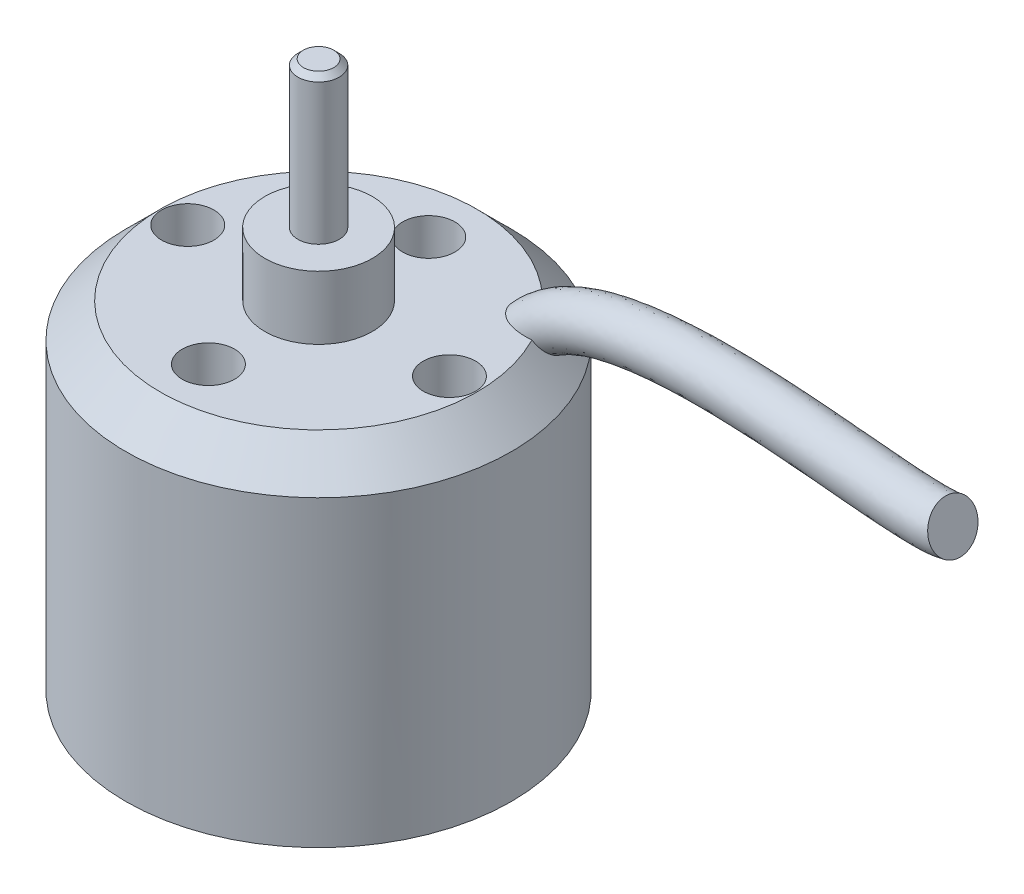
SolidWorks part; units mm, degrees
ref_plane "Plan de face" through (0, 0, 0) normal (0, 0, 1) x (1, 0, 0)
ref_plane "Plan de dessus" through (0, 0, 0) normal (0, 1, 0) x (1, 0, 0)
ref_plane "Plan de droite" through (0, 0, 0) normal (1, 0, 0) x (0, 0, -1)
sketch "Esquisse1" plane through (0, 0, 0) normal (0, 0, 1) x (1, 0, 0)
  line L0 (4, 0.4) -> (1.5, 0.4)
  line L1 (4, 0.4) -> (4, 5)
  line L2 (4, 5) -> (14, 5)
  line L3 (14, 5) -> (14, 27)
  line L4 (14, 27) -> (11.5, 29.5)
  line L5 (11.5, 29.5) -> (3.9, 29.5)
  line L6 (3.9, 29.5) -> (3.9, 34.1)
  line L7 (3.9, 34.1) -> (1.5, 34.1)
  line L8 (1.5, 34.1) -> (1.5, 44.3)
  line L9 (1.1, 44.7) -> (0, 44.7)
  line L10 (1.5, 0.4) -> (1.5, 0)
  line L11 (1.5, 0) -> (0, 0)
  line L12 (1.5, 44.3) -> (1.1, 44.7)
  line L13 (0, 44.7) -> (0, 0)
  point P9 (1.5, 44.7)
  dimension "D1" = 44.7
  dimension "D3" = 5
  dimension "D4" = 4.6
  dimension "D7" = 24.5
  dimension "D8" = 45
  dimension "D11" = 10.6
  dimension "D14" = 0.4
revolve "Révolution1" add sketch "Esquisse1" angle 360 about L13
sketch "Esquisse2" plane through (0, 29.5, 0) normal (0, 1, 0) x (1, 0, 0)
  line L0 (9.5, 0) -> (-9.5, 0) construction
  line L1 (0, 0) -> (0, -8) construction
  circle A0 centre (9.5, 0) radius 1.9
  circle A1 centre (-9.5, 0) radius 1.9
  circle A2 centre (0, -8) radius 1.9
  circle A3 centre (0, 8) radius 1.9
  dimension "D2" = 3.8
  dimension "D3" = 3.8
  dimension "D4" = 3.8
  dimension "D1" = 19
  dimension "D5" = 8
extrude "Extrusion2" cut sketch "Esquisse2" against normal blind 10
sketch "Esquisse3" plane through (0, 5, 0) normal (0, -1, 0) x (1, 0, 0)
  circle A0 centre (7, -7) radius 1.75
  circle A1 centre (0, 0) radius 14 construction
  dimension "D1" = 3.5
  dimension "D2" = 7
  dimension "D3" = 7
ref_plane "Plan1" through (0, 0, -7) normal (0, 0, 1) x (1, 0, 0)
sketch "Esquisse4" plane through (0, 0, -7) normal (0, 0, 1) x (1, 0, 0)
  line L0 (5.25, 5) -> (8.75, 5) construction
  spline S0 degree 3 poles (7, 5) (7.0966, 10.5108) (-0.7581, 39.4022) (35.1629, 30.1776) (39.0505, 31.3187) knots 0 0 0 0 0.430023 1 1 1 1
sweep "Balayage1" add profiles "Esquisse3" path "Esquisse4"
